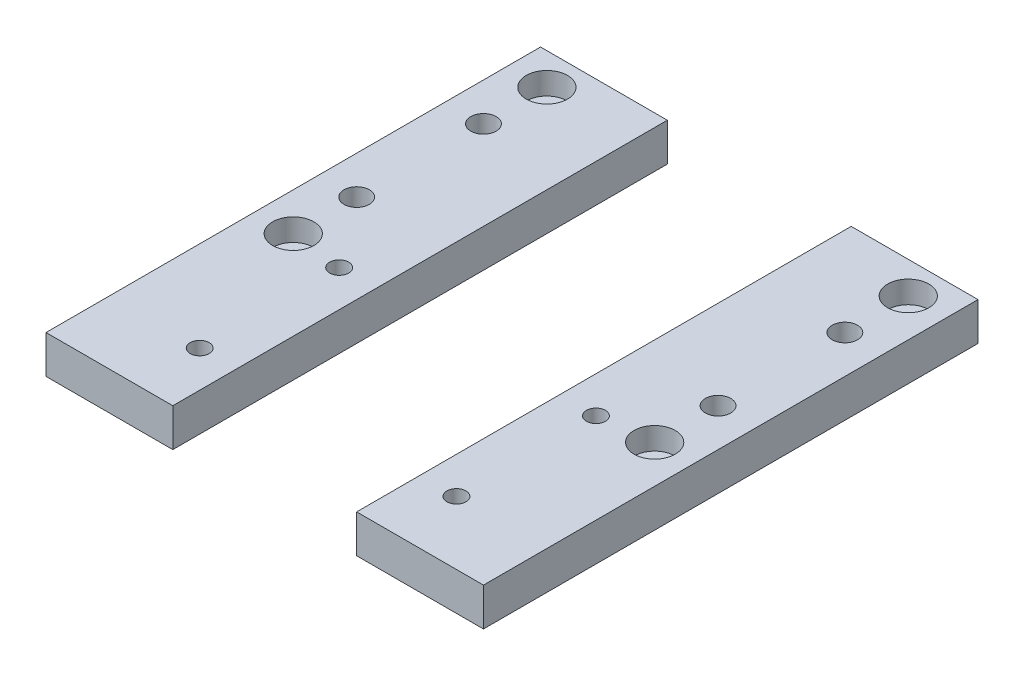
SolidWorks part; units mm, degrees
ref_plane "前视基准面" through (0, 0, 0) normal (0, 0, 1) x (1, 0, 0)
ref_plane "上视基准面" through (0, 0, 0) normal (0, 1, 0) x (1, 0, 0)
ref_plane "右视基准面" through (0, 0, 0) normal (1, 0, 0) x (0, 0, -1)
sketch "草图1" plane through (0, 0, 0) normal (0, 0, 1) x (1, 0, 0)
  line L0 (0, 0) -> (0, 6)
  line L1 (20, 0) -> (20, 6)
  line L2 (0, 0) -> (20, 0)
  line L3 (0, 6) -> (20, 6)
  line L4 (69, 6) -> (49, 6)
  line L5 (69, 0) -> (49, 0)
  line L6 (49, 0) -> (49, 6)
  line L7 (69, 0) -> (69, 6)
extrude "凸台-拉伸1" add sketch "草图1" along normal blind 78
sketch "草图2" plane through (0, 6, 0) normal (0, 1, 0) x (1, 0, 0)
  circle A0 centre (6, -5) radius 1.75
  circle A1 centre (6, -45) radius 1.75
  circle A2 centre (6, -35) radius 2
  circle A3 centre (6, -15) radius 2
  circle A4 centre (14.25, -46.012) radius 1.5
  circle A5 centre (14.25, -68.012) radius 1.5
  circle A6 centre (54.75, -68.012) radius 1.5
  circle A7 centre (54.75, -46.012) radius 1.5
  circle A8 centre (63, -15) radius 2
  circle A9 centre (63, -35) radius 2
  circle A10 centre (63, -45) radius 1.75
  circle A11 centre (63, -5) radius 1.75
extrude "切除-拉伸1" cut sketch "草图2" against normal blind 78
sketch "草图3" plane through (0, 6, 0) normal (0, 1, 0) x (1, 0, 0)
  circle A0 centre (6, -5) radius 3.25
  circle A1 centre (6, -45) radius 3.25
  circle A2 centre (63, -45) radius 3.25
  circle A3 centre (63, -5) radius 3.25
extrude "切除-拉伸2" cut sketch "草图3" against normal blind 3.5
